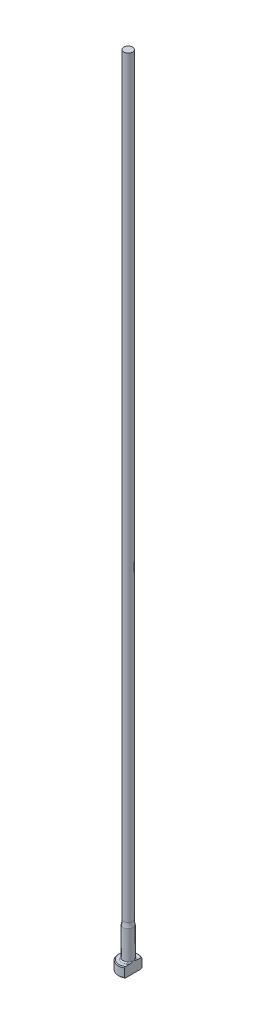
SolidWorks part; units mm, degrees
ref_plane "Front Plane" through (0, 0, 0) normal (0, 0, 1) x (1, 0, 0)
ref_plane "Top Plane" through (0, 0, 0) normal (0, 1, 0) x (1, 0, 0)
ref_plane "Right Plane" through (0, 0, 0) normal (1, 0, 0) x (0, 0, -1)
sketch "Sketch1" plane through (0, 0, 0) normal (0, 0, 1) x (1, 0, 0)
  line L0 (0, 259.9588) -> (0, -15.1925) construction
  line L1 (0, 0) -> (-3.175, 0)
  line L2 (-3.175, 0) -> (-3.175, 3.175)
  line L3 (-3.175, 3.175) -> (-1.5875, 3.175)
  line L4 (-1.3881, 14.2788) -> (-1.3881, 254)
  line L5 (-1.3881, 254) -> (0, 254)
  line L6 (0, 254) -> (0, 0)
  line L7 (-1.5875, 3.175) -> (-1.5875, 12.7)
  arc A0 (-1.5875, 12.7) -> (-1.3881, 14.2788) centre (-7.7381, 14.2788) ccw
  point P13 (-1.5875, 0)
  dimension "D1" = 6.35
  dimension "L" = 254
  dimension "D2" = 3.175
  dimension "H" = 6.35
  dimension "T" = 3.175
  dimension "D" = 2.7762
  dimension "S" = 12.7
revolve "Revolve1" add sketch "Sketch1" angle 360 about L0
chamfer "Chamfer1" distance 0.254 angle 45 2 edges at (0, 3.175, 3.175) (0, 0, 3.175)
fillet "Fillet1" radius 0.381 1 edges at (0, 3.175, 1.5875)
sketch "Sketch2" plane through (0, 0, 0) normal (0, 1, 0) x (1, 0, 0)
  line L0 (1.5875, -2.7496) -> (1.5875, 2.7496)
  circle A0 centre (0, 0) radius 3.175 construction
  arc A2 (1.5875, -2.7496) -> (1.5875, 2.7496) centre (0, 0) ccw
  circle A3 centre (0, 0) radius 3.175 construction
  circle A4 centre (0, 0) radius 1.5875 construction
extrude "Key Head" cut sketch "Sketch2" along normal up to next
